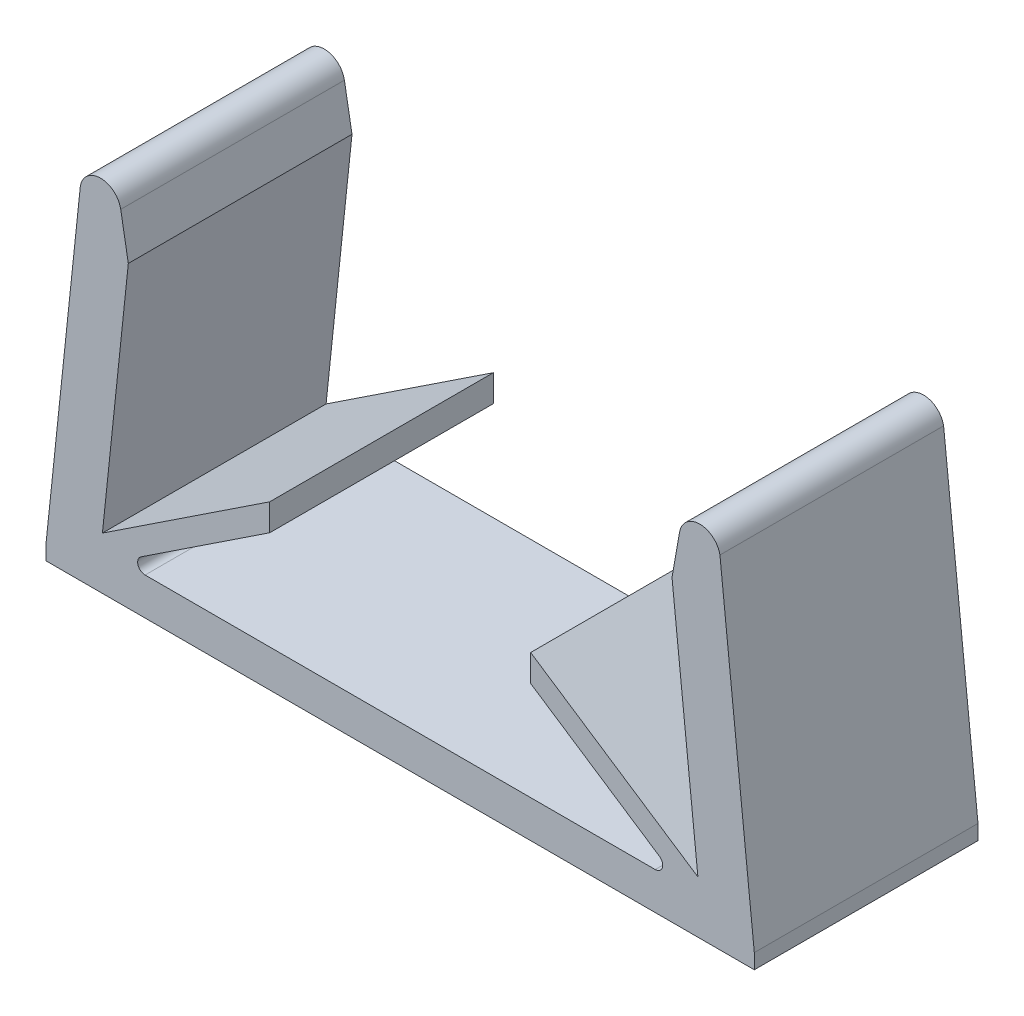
SolidWorks part; units mm, degrees
ref_plane "正面" through (0, 0, 0) normal (0, 0, 1) x (1, 0, 0)
ref_plane "平面" through (0, 0, 0) normal (0, 1, 0) x (1, 0, 0)
ref_plane "右側面" through (0, 0, 0) normal (1, 0, 0) x (0, 0, -1)
sketch "ｽｹｯﾁ1" plane through (0, 0, 0) normal (0, 0, 1) x (1, 0, 0)
  line L45 (7.9865, 1.4014) -> (7.2916, 8.0128)
  line L46 (-6.8414, 1) -> (6.8414, 1)
  line L47 (-7.9865, 1.4014) -> (-7.2916, 8.0128)
  line L48 (-9.4995, 0.4) -> (-8.5773, 9.1744)
  line L49 (7.4952, 9.1675) -> (7.2916, 8.0128)
  line L50 (9.4995, 0.4) -> (8.5773, 9.1744)
  line L51 (-3.5, 3.6515) -> (-3.5, 4.371)
  line L52 (-3.5, 4.371) -> (-7.9865, 1.4014)
  line L53 (-3.5, 3.6515) -> (-6.9518, 1.3668)
  line L54 (3.5, 3.6515) -> (6.9518, 1.3668)
  line L55 (3.5, 4.371) -> (7.9865, 1.4014)
  line L56 (3.5, 3.6515) -> (3.5, 4.371)
  line L57 (-9.4995, 0) -> (9.4995, 0)
  line L58 (9.4995, 0) -> (9.4995, 0.4)
  line L59 (-9.4995, 0) -> (-9.4995, 0.4)
  line L60 (-7.4952, 9.1675) -> (-7.2916, 8.0128)
  arc A0 (8.5773, 9.1744) -> (7.4952, 9.1675) centre (8.0369, 9.072) ccw
  arc A1 (-7.4952, 9.1675) -> (-8.5773, 9.1744) centre (-8.0369, 9.072) ccw
  arc A2 (-6.9518, 1.3668) -> (-6.8414, 1) centre (-6.8414, 1.2) ccw
  arc A3 (6.9518, 1.3668) -> (6.8414, 1) centre (6.8414, 1.2) cw
extrude "押し出し1" add sketch "ｽｹｯﾁ1" along normal mid plane 6
